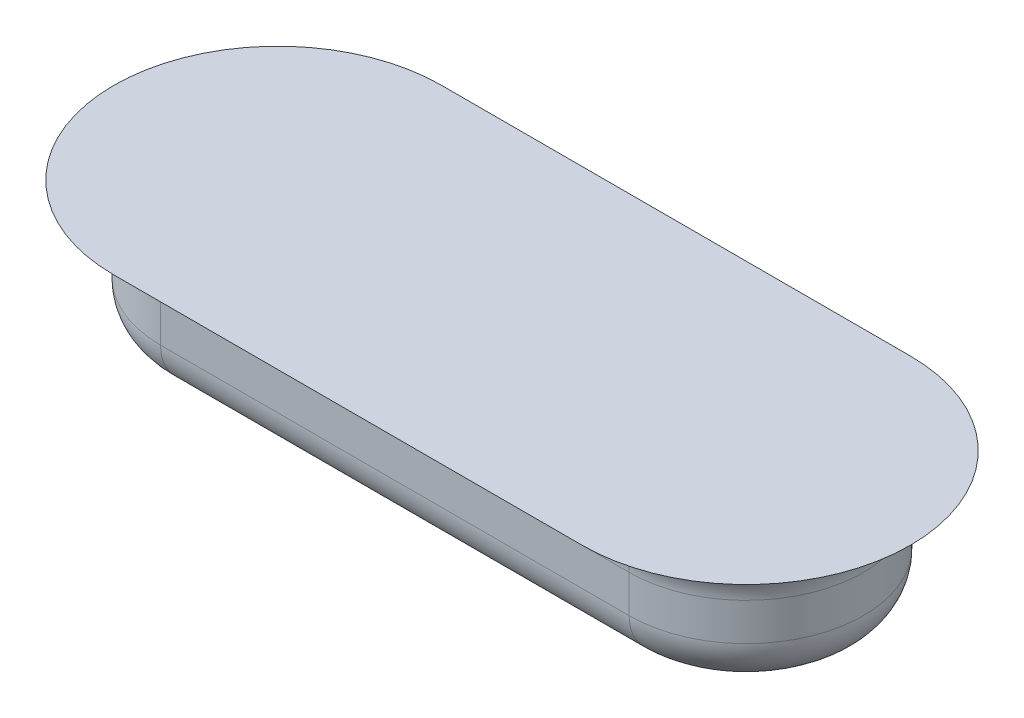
SolidWorks part; units mm, degrees
ref_plane "Front Plane" through (0, 0, 0) normal (0, 0, 1) x (1, 0, 0)
ref_plane "Top Plane" through (0, 0, 0) normal (0, 1, 0) x (1, 0, 0)
ref_plane "Right Plane" through (0, 0, 0) normal (1, 0, 0) x (0, 0, -1)
sketch "Sketch1" plane through (0, 0, 0) normal (0, 1, 0) x (1, 0, 0)
  line L1 (-80.1806, 58.7612) -> (93.0701, 58.7612)
  line L2 (-80.1806, 58.7612) -> (-80.1806, -62.5522)
  line L3 (-80.1806, -62.5522) -> (93.0701, -62.5522)
  line L4 (93.0701, 58.7612) -> (93.0701, -62.5522)
extrude "Extrude1" add sketch "Sketch1" along normal blind 32.512
sketch "Sketch2" plane through (0, 0, 0) normal (0, -1, 0) x (1, 0, 0)
  line L0 (-25.4, 0) -> (25.4, 0) construction
  line L1 (-25.4, -12.7) -> (25.4, -12.7)
  line L2 (-25.4, 12.7) -> (25.4, 12.7)
  arc A0 (-25.4, -12.7) -> (-25.4, 12.7) centre (-25.4, 0) cw
  arc A1 (25.4, -12.7) -> (25.4, 12.7) centre (25.4, 0) ccw
  dimension "D3" = 50.8
  dimension "D1" = 12.7
  dimension "D2" = 12.7
extrude "Extrude2" add sketch "Sketch2" along normal blind 14.224
fillet "Fillet1" radius 5.08 8 edges at (-38.1, 0, 0) (0, 0, -12.7) (38.1, 0, 0) (0, 0, 12.7) (-38.1, -14.224, 0) (0, -14.224, -12.7) (38.1, -14.224, 0) (0, -14.224, 12.7)
sketch "Sketch4" plane through (0, 0, 0) normal (0, -1, 0) x (1, 0, 0)
  line L4 (-80.1806, 62.5522) -> (-80.1806, -58.7612)
  line L5 (-80.1806, -58.7612) -> (93.0701, -58.7612)
  line L6 (93.0701, -58.7612) -> (93.0701, 62.5522)
  line L7 (93.0701, 62.5522) -> (-80.1806, 62.5522)
  line L8 (-80.1806, 62.5522) -> (-80.1806, -58.7612)
  line L9 (-80.1806, -58.7612) -> (93.0701, -58.7612)
  line L10 (93.0701, -58.7612) -> (93.0701, 62.5522)
  line L11 (93.0701, 62.5522) -> (-80.1806, 62.5522)
  dimension "D1" = 0
extrude "Cut-Extrude1" cut sketch "Sketch4" against normal through all
sketch "Sketch5" plane through (0, 0, 0) normal (0, 1, 0) x (-1, 0, 0)
  line L0 (25.4, 0) -> (-25.4, 0) construction
  line L1 (0, 0) -> (0, 17.78) construction
  line L2 (-25.4, -17.78) -> (25.4, -17.78)
  line L3 (25.4, 17.78) -> (-25.4, 17.78)
  line L4 (-25.4, -17.78) -> (25.4, -17.78)
  line L5 (25.4, 17.78) -> (-25.4, 17.78)
  arc A2 (25.4, -17.78) -> (25.4, 17.78) centre (25.4, 0) ccw
  arc A3 (-25.4, 17.78) -> (-25.4, -17.78) centre (-25.4, 0) ccw
  arc A4 (25.4, -17.78) -> (25.4, 17.78) centre (25.4, 0) ccw
  arc A5 (-25.4, 17.78) -> (-25.4, -17.78) centre (-25.4, 0) ccw
  dimension "D1" = 0
sketch "Sketch3" plane through (0, -14.224, 0) normal (0, -1, 0) x (1, 0, 0)
  circle A0 centre (0, 0) radius 4.445
  dimension "D1" = 8.89
